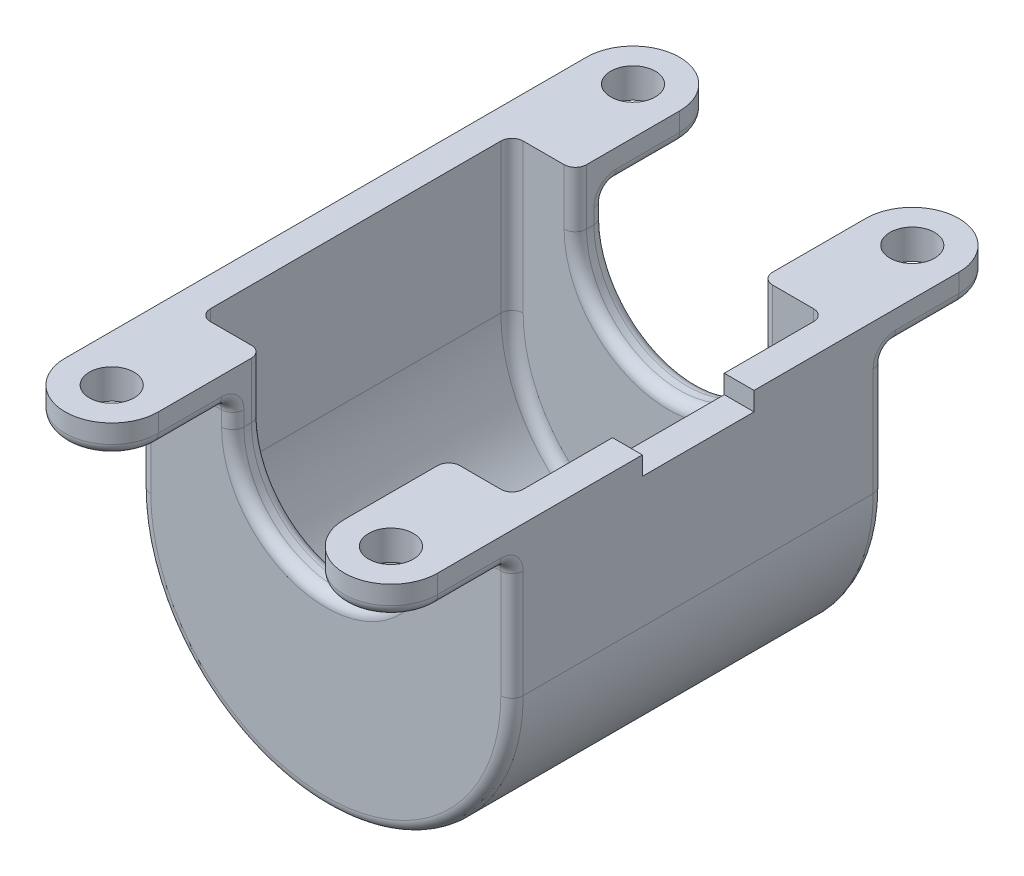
SolidWorks part; units mm, degrees
ref_plane "Front Plane" through (0, 0, 0) normal (0, 0, 1) x (1, 0, 0)
ref_plane "Top Plane" through (0, 0, 0) normal (0, 1, 0) x (1, 0, 0)
ref_plane "Right Plane" through (0, 0, 0) normal (1, 0, 0) x (0, 0, -1)
sketch "Sketch1" plane through (0, 0, 0) normal (0, 0, 1) x (1, 0, 0)
  line L0 (-25, 15) -> (-25, 0)
  line L1 (25, 0) -> (25, 15)
  line L2 (25, 15) -> (50, 15)
  line L3 (50, 15) -> (50, -25)
  line L4 (-25, 15) -> (-50, 15)
  line L5 (-50, 15) -> (-50, -25)
  arc A0 (-25, 0) -> (25, 0) centre (0, 0) ccw
  arc A1 (-50, -25) -> (50, -25) centre (0, -25) ccw
  dimension "D1" = 25
  dimension "D2" = 50
  dimension "D3" = 90
  dimension "D4" = 40
extrude "Boss-Extrude1" add sketch "Sketch1" along normal mid plane 100
shell "Shell1" thickness 8
sketch "Sketch2" plane through (0, 15, 0) normal (0, 1, 0) x (1, 0, 0)
  line L0 (-50, -50) -> (-50, 50) construction
  line L1 (-50, -50) -> (-25, -50)
  line L2 (-50, -50) -> (-50, -70)
  line L3 (-50, -70) -> (-25, -70) construction
  line L4 (-25, -50) -> (-25, -70)
  line L5 (-50, 0) -> (50, 0) construction
  line L6 (50, -50) -> (50, 50) construction
  arc A0 (-50, -70) -> (-25, -70) centre (-37.5, -70) ccw
  dimension "D1" = 70
extrude "Boss-Extrude2" add sketch "Sketch2" against normal blind 8
hole_wizard "Ø12.0 (12) Diameter Hole1" positions "Sketch4" profile "Sketch3" hole size "Ø12.0" standard "ANSI Metric"
sketch "Sketch4" plane through (0, 15, 0) normal (0, 1, 0) x (1, 0, 0)
  point P0 (-37.5, -70)
sketch "Sketch3" plane through (-37.5, 15, 70) normal (1, 0, 0) x (0, 0, 1)
  line L0 (0, 0) -> (0, 90)
  line L1 (0, 90) -> (6, 90)
  line L2 (6, 90) -> (6, 0)
  line L5 (6, 0) -> (0, 0)
  line L11 (0, -6.35) -> (0, 107.95) construction
  dimension "Thru Hole Dia." = 12
  dimension "Thru Hole Depth" = 90
mirror "Mirror1" about plane through (0, 0, 0) normal (1, 0, 0) of "Ø12.0 (12) Diameter Hole1", "Boss-Extrude2"
mirror "Mirror2" about plane through (0, 0, 0) normal (0, 0, 1) of "Mirror1", "Boss-Extrude2", "Ø12.0 (12) Diameter Hole1"
sketch "Sketch6" plane through (0, 0, 0) normal (1, 0, 0) x (0, 0, -1)
  line L0 (-70, 15) -> (70, 15) construction
  line L1 (-15, 20) -> (15, 20)
  line L2 (-15, 20) -> (-15, 10)
  line L3 (-15, 10) -> (15, 10)
  line L4 (15, 20) -> (15, 10)
  line L5 (-15, 20) -> (15, 10) construction
  line L6 (-15, 10) -> (15, 20) construction
  point P0 (0, 15)
  dimension "D1" = 5
  dimension "D2" = 30
extrude "Cut-Extrude1" cut sketch "Sketch6" along normal through all
fillet "Fillet1" radius 3 4 edges at (-37.5, 7, -50) (37.5, 7, 50)
fillet "Fillet2" radius 3 44 edges at (0, -75, 50) (-37.5, 7, -82.5) (-25, 7, -61.5) (50, -10.5, 50) (-50, 7, -61.5) (-50, -10.5, -50) (50, 7, 61.5) (25, 2, 50) (-50, 6.1213, -50.8787) (-25, 6.1213, -50.8787) (50, 6.1213, -50.8787) (25, 6.1213, -50.8787) (50, 6.1213, 50.8787) (25, 6.1213, 50.8787) (-50, 6.1213, 50.8787) (-25, 6.1213, 50.8787) (0, -25, 50) (-42, -5, -42) (0, -67, -42) (42, -5, -42) (25, 7.5, -42) (0, -25, -42) (-25, 7.5, -42) (-42, -5, 42) (0, -67, 42) (42, -5, 42) (25, 7.5, 42) (0, -25, 42) (-25, 7.5, 42) (-37.5, 7, 82.5) (37.5, 7, 82.5) (25, 7, 61.5) (-25, 2, -50) (0, -25, -50) (37.5, 7, -82.5) (0, -75, -50)
